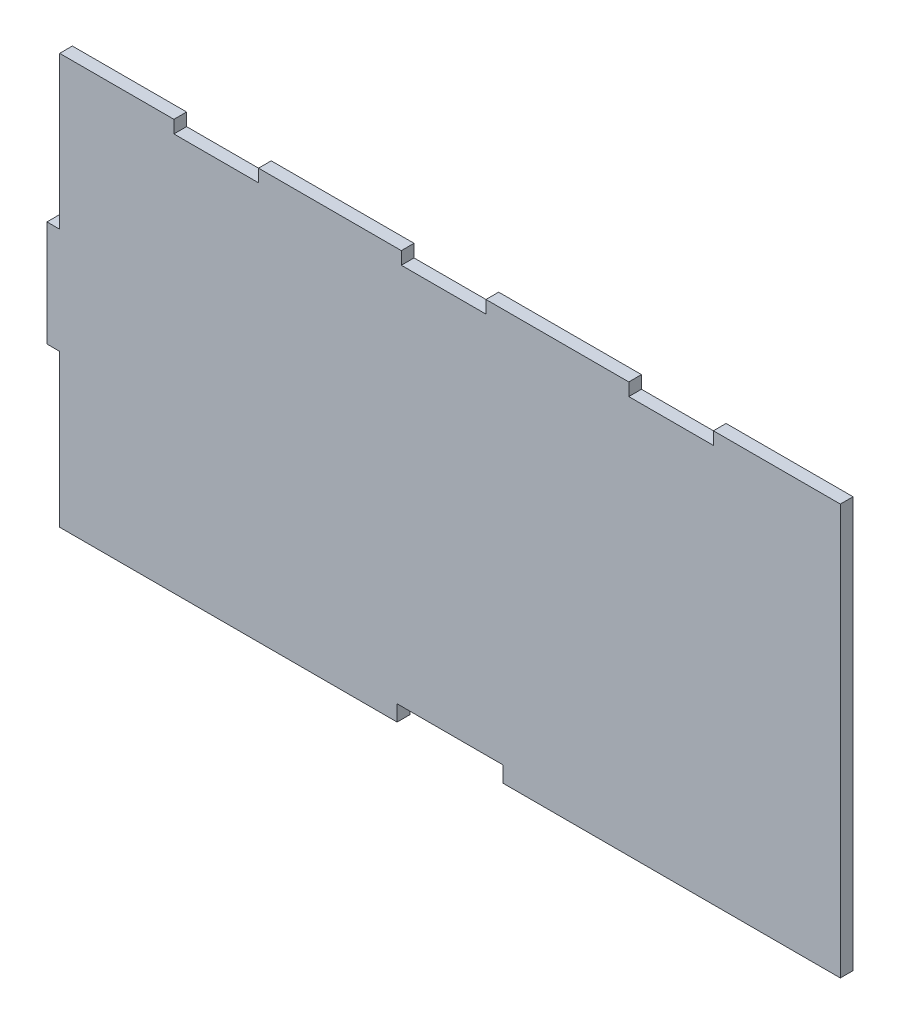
SolidWorks part; units mm, degrees
ref_plane "Alzado" through (0, 0, 0) normal (0, 0, 1) x (1, 0, 0)
ref_plane "Planta" through (0, 0, 0) normal (0, 1, 0) x (1, 0, 0)
ref_plane "Vista lateral" through (0, 0, 0) normal (1, 0, 0) x (0, 0, -1)
sketch "Croquis1" plane through (0, 0, 0) normal (0, 0, 1) x (1, 0, 0)
  line L0 (-261, 194) -> (-369, 194)
  line L1 (369, -194) -> (50, -194)
  line L2 (369, -194) -> (369, 194)
  line L3 (369, 194) -> (249, 194)
  line L4 (-369, -194) -> (-369, -50)
  line L5 (369, -194) -> (-369, 194) construction
  line L6 (369, 194) -> (-369, -194) construction
  line L7 (-261, 194) -> (-261, 182)
  line L8 (-261, 182) -> (-181, 182)
  line L9 (-181, 194) -> (-181, 182)
  line L10 (-46, 194) -> (-46, 182)
  line L11 (-46, 182) -> (34, 182)
  line L12 (34, 194) -> (34, 182)
  line L13 (169, 194) -> (169, 182)
  line L14 (169, 182) -> (249, 182)
  line L15 (249, 194) -> (249, 182)
  line L16 (-46, 194) -> (-181, 194)
  line L17 (169, 194) -> (34, 194)
  line L18 (-369, 50) -> (-369, 194)
  line L19 (-369, 50) -> (-381, 50)
  line L20 (-369, -50) -> (-381, -50)
  line L21 (-381, 50) -> (-381, -50)
  line L22 (-50, -194) -> (-369, -194)
  line L30 (50, -194) -> (50, -179)
  line L31 (50, -179) -> (-50, -179)
  line L32 (-50, -194) -> (-50, -179)
  point P0 (0, 0)
  point P5 (0, -194)
  point P22 (-381, 0)
  point P23 (0, -179)
  dimension "D1" = 388
  dimension "D2" = 108
  dimension "D3" = 80
  dimension "D4" = 135
  dimension "D5" = 80
  dimension "D6" = 135
  dimension "D7" = 80
  dimension "D8" = 12
  dimension "D9" = 12
  dimension "D10" = 100
  dimension "D11" = 750
  dimension "D15" = 15
  dimension "D16" = 100
extrude "Saliente-Extruir1" add sketch "Croquis1" along normal blind 12
